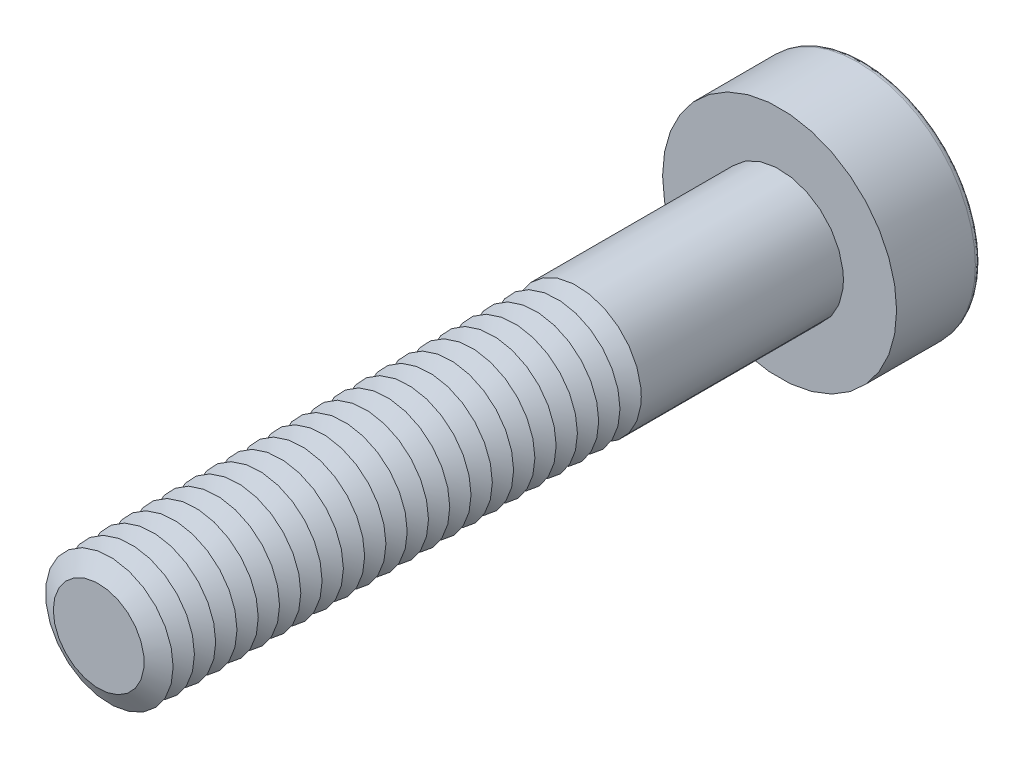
SolidWorks part; units mm, degrees
ref_plane "Front Plane" through (0, 0, 0) normal (0, 0, 1) x (1, 0, 0)
ref_plane "Top Plane" through (0, 0, 0) normal (0, 1, 0) x (1, 0, 0)
ref_plane "Right Plane" through (0, 0, 0) normal (1, 0, 0) x (0, 0, -1)
sketch "Sketch1" plane through (0, 0, 0) normal (0, 0, 1) x (1, 0, 0)
  circle A0 centre (0, 0) radius 1.5
  dimension "D1" = 3
extrude "Boss-Extrude1" add sketch "Sketch1" along normal blind 16
sketch "Sketch2" plane through (0, 0, 0) normal (0, 0, -1) x (-1, 0, 0)
  circle A0 centre (0, 0) radius 2.75
  dimension "D1" = 5.5
extrude "Boss-Extrude2" add sketch "Sketch2" along normal blind 2
sketch "Sketch3" plane through (0, 0, -2) normal (0, 0, -1) x (-1, 0, 0)
  line L1 (-0.5774, 1) -> (-1.1547, 0)
  line L2 (-1.1547, 0) -> (-0.5774, -1)
  line L3 (-0.5774, -1) -> (0.5774, -1)
  line L4 (0.5774, -1) -> (1.1547, 0)
  line L5 (1.1547, 0) -> (0.5774, 1)
  line L6 (0.5774, 1) -> (-0.5774, 1)
  circle A0 centre (0, 0) radius 1 construction
  dimension "D1" = 2
extrude "Cut-Extrude1" cut sketch "Sketch3" against normal blind 1.5
fillet "Fillet1" radius 0.15 1 edges at (-2.75, 0, -2)
sketch "Sketch4" plane through (0, 0, -0.5) normal (0, 0, -1) x (-1, 0, 0)
  line L0 (0.5774, -1) -> (1.1547, 0) construction
  circle A0 centre (0, 0) radius 1
extrude "Cut-Extrude2" cut sketch "Sketch4" against normal through all draft 60
sketch "Sketch5" plane through (0, 0, -2) normal (0, 0, -1) x (-1, 0, 0)
  circle A0 centre (0, 0) radius 1.1547
extrude "Cut-Extrude3" cut sketch "Sketch5" against normal through all draft 75
sketch "Sketch7" plane through (0, 0, 0) normal (1, 0, 0) x (0, 0, -1)
  line L25 (-16, 1.067) -> (-15.75, 1.5)
  line L26 (-16, 1.5) -> (-16, -1.5) construction
  line L27 (-15.75, 1.5) -> (-16.25, 1.5)
  line L28 (-16.25, 1.5) -> (-16, 1.067)
  line L29 (0, 1.5) -> (-16, 1.5) construction
  dimension "D1" = 0.5
revolve "Cut-Revolve1" cut sketch "Sketch7" angle 360 about axis through (0, 0, 16) along (0, 0, -1)
pattern_linear "LPattern1" count 23 spacing 0.5 along (0, 0, -1) of "Cut-Revolve1"
